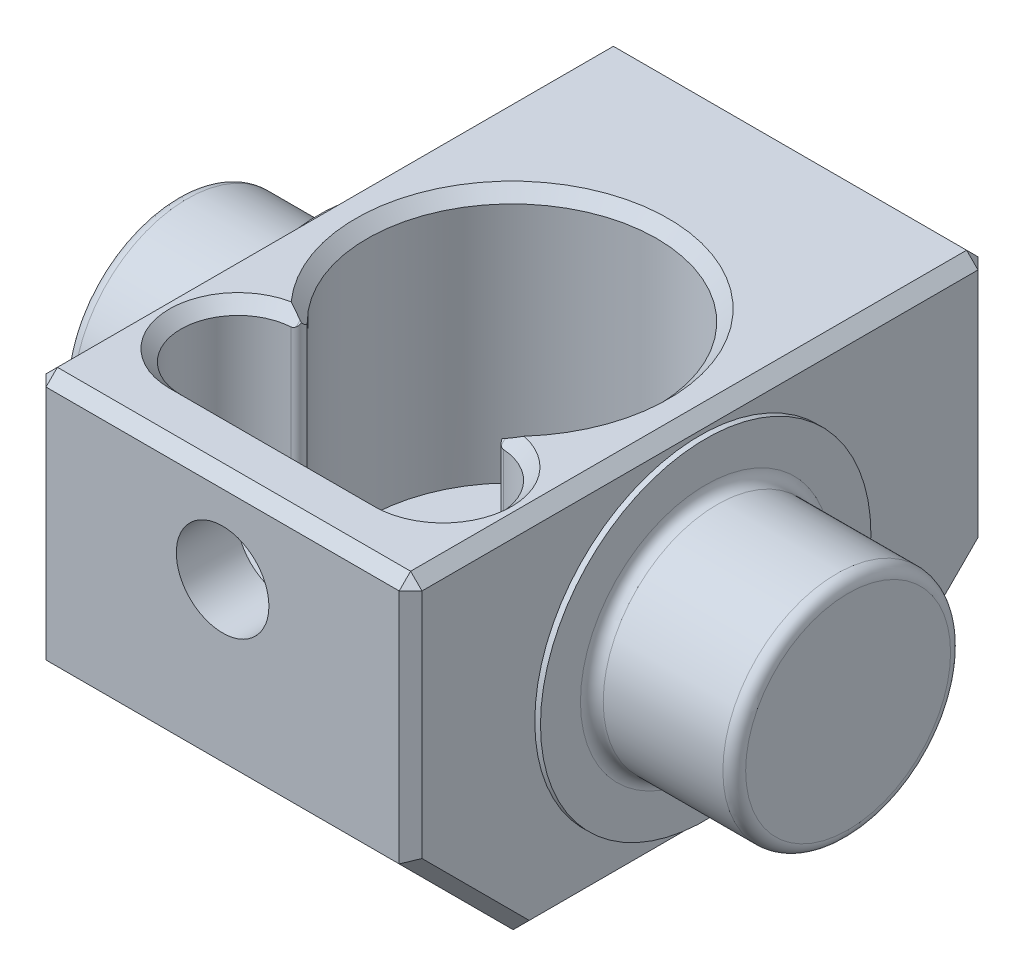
SolidWorks part; units mm, degrees
ref_plane "Front Plane" through (0, 0, 0) normal (0, 0, 1) x (1, 0, 0)
ref_plane "Top Plane" through (0, 0, 0) normal (0, 1, 0) x (1, 0, 0)
ref_plane "Right Plane" through (0, 0, 0) normal (1, 0, 0) x (0, 0, -1)
sketch "Sketch1" plane through (0, 0, 0) normal (1, 0, 0) x (0, 0, -1)
  line L1 (-12.7, 7.9375) -> (12.7, 7.9375)
  line L2 (-12.7, 7.9375) -> (-12.7, -7.9375)
  line L3 (-12.7, -7.9375) -> (12.7, -7.9375)
  line L4 (12.7, 7.9375) -> (12.7, -7.9375)
  line L5 (-12.7, 7.9375) -> (12.7, -7.9375) construction
  line L6 (-12.7, -7.9375) -> (12.7, 7.9375) construction
  point P0 (0, 0)
  dimension "D1" = 15.875
  dimension "D2" = 25.4
extrude "Boss-Extrude1" add sketch "Sketch1" along normal mid plane 16.5
sketch "Sketch2" plane through (0, 0, 0) normal (0, 0, 1) x (1, 0, 0)
  line L0 (0, 0) -> (15.0375, 0) construction
  line L1 (8.25, 7.25) -> (8.5, 7.25)
  line L2 (8.25, 7.9375) -> (8.25, -7.9375) construction
  line L3 (8.5, 7.25) -> (8.5, 4.9962)
  line L4 (8.5, 4.9962) -> (14.75, 4.9962)
  line L5 (14.75, 4.9962) -> (14.75, 0)
  line L6 (14.75, 0) -> (8.25, 0)
  line L7 (8.25, 0) -> (8.25, 7.25)
  line L8 (0, 10.193) -> (0, -1.9896) construction
  dimension "D1" = 14.5
  dimension "D2" = 17
  dimension "D3" = 9.9924
  dimension "D4" = 29.5
revolve "Revolve1" add sketch "Sketch2" angle 360 about L0
mirror "Mirror1" about plane through (0, 0, 0) normal (1, 0, 0) of "Revolve1"
sketch "Sketch3" plane through (0, 0, 0) normal (0, 0, 1) x (1, 0, 0)
  line L0 (0, 7.9375) -> (0, -3.175)
  line L1 (8.25, 7.9375) -> (-8.25, 7.9375) construction
  line L2 (0, -3.175) -> (-6.3538, -3.175)
  line L3 (-6.3538, -3.175) -> (-6.3538, 7.9375)
  line L4 (-6.3538, 7.9375) -> (0, 7.9375)
  line L5 (0, 10.1247) -> (0, -4.0859) construction
  dimension "D1" = 12.7076
  dimension "D2" = 3.175
revolve "Cut-Revolve1" cut sketch "Sketch3" angle 360 about L5
sketch "Sketch4" plane through (0, 0, 0) normal (0, 0, 1) x (1, 0, 0)
  line L0 (0, -7.9375) -> (0, -3.175)
  line L1 (8.25, -7.9375) -> (-8.25, -7.9375) construction
  line L2 (0, -7.9375) -> (-3.5719, -7.9375)
  line L3 (-3.5719, -7.9375) -> (-3.5719, -3.175)
  line L4 (6.3538, -3.175) -> (-6.3538, -3.175) construction
  line L5 (-3.5719, -3.175) -> (0, -3.175)
  line L6 (0, -1.9252) -> (0, -10.0139) construction
  dimension "D1" = 7.1437
revolve "Cut-Revolve2" cut sketch "Sketch4" angle 360 about L6
sketch "Sketch5" plane through (0, 7.9375, 0) normal (0, 1, 0) x (1, 0, 0)
  line L0 (-4.5, -7.5273) -> (4.5, -7.5273) construction
  line L1 (-4.5, -5.0254) -> (4.5, -5.0254)
  line L2 (-4.5, -10.0292) -> (4.5, -10.0292)
  line L3 (-1.1729, 0) -> (1.6976, 0) construction
  arc A0 (-4.5, -5.0254) -> (-4.5, -10.0292) centre (-4.5, -7.5273) ccw
  arc A1 (4.5, -10.0292) -> (4.5, -5.0254) centre (4.5, -7.5273) ccw
  circle A4 centre (0, 0) radius 6.3538 construction
  point P2 (0, -7.5273)
  dimension "D1" = 11.3792
  dimension "D5" = 16.383
  dimension "D2" = 5.0254
  dimension "D3" = 5.0038
  dimension "D4" = 9
extrude "Cut-Extrude1" cut sketch "Sketch5" against normal blind 6.5
chamfer "Chamfer1" distance 5 angle 45 2 edges at (0, -7.9375, -12.7) (0, -7.9375, 12.7)
chamfer "Chamfer2" distance 0.5 angle 45 14 edges at (8.25, -5.4375, 10.2) (8.25, 2.5, 12.7) (8.25, -7.9375, 0) (8.25, -5.4375, -10.2) (8.25, 2.5, -12.7) (-8.25, 2.5, 12.7) (-8.25, -5.4375, 10.2) (-8.25, -7.9375, 0) (-8.25, -5.4375, -10.2) (-8.25, 2.5, -12.7) (0, 7.9375, -12.7) (8.25, 7.9375, 0) (0, 7.9375, 12.7) (-8.25, 7.9375, 0)
chamfer "Chamfer4" distance 0.508 angle 45 6 edges at (-4.194, 7.9375, 5.0254) (-7.0019, 7.9375, 7.5273) (0, 7.9375, 10.0292) (7.0019, 7.9375, 7.5273) (4.194, 7.9375, 5.0254) (0, 7.9375, -6.3538)
fillet "Fillet1" radius 0.3 2 edges at (3.888, 4.4335, 5.0254) (-3.888, 4.4335, 5.0254)
chamfer "Chamfer5" distance 0.5 angle 45 2 edges at (0, -3.175, 3.5719) (0, -7.9375, 3.5719)
fillet "Fillet2" radius 0.5 2 edges at (-14.75, 0, 4.9962) (14.75, 0, 4.9962)
fillet "Fillet3" radius 0.5 2 edges at (8.5, 0, 4.9962) (-8.5, 0, 4.9962)
sketch "Sketch9" plane through (0, 0, 12.7) normal (0, 0, 1) x (1, 0, 0)
  line L0 (0, 1.4375) -> (0, 7.9375) construction
  line L1 (-4.5, 1.4375) -> (4.5, 1.4375) construction
  line L2 (-7.75, 7.9375) -> (7.75, 7.9375) construction
  circle A0 centre (0, 3.9975) radius 2.032
  circle A1 centre (0, 3.9975) radius 3.3274 construction
  dimension "D1" = 4.064
  dimension "D2" = 6.6548
  dimension "D3" = 3.94
extrude "Cut-Extrude2" cut sketch "Sketch9" against normal up to next
